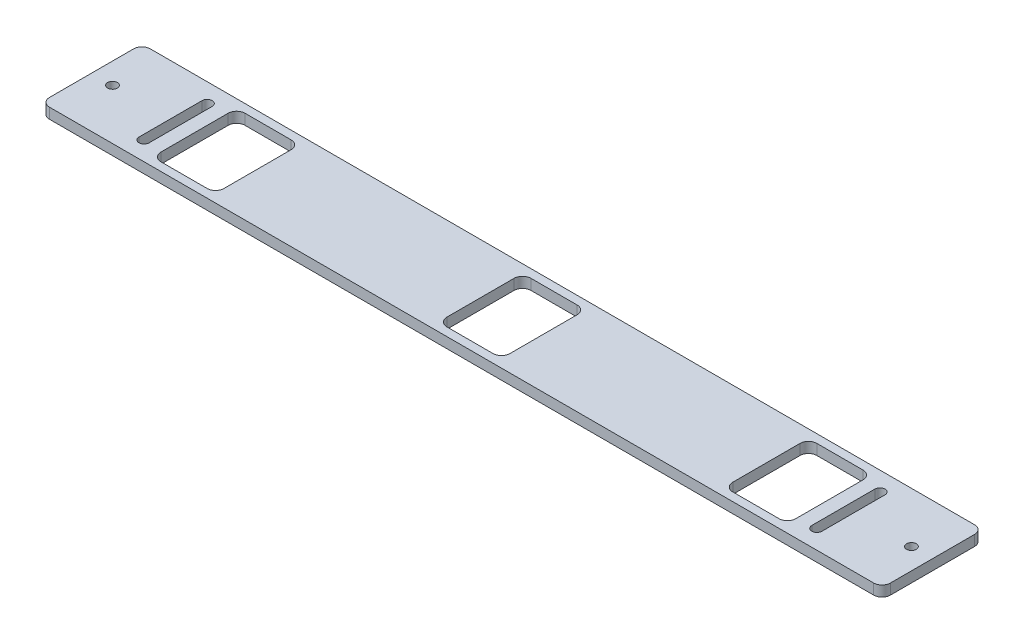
SolidWorks part; units mm, degrees
ref_plane "Front" through (0, 0, 0) normal (0, 0, 1) x (1, 0, 0)
ref_plane "Top" through (0, 0, 0) normal (0, 1, 0) x (1, 0, 0)
ref_plane "Right" through (0, 0, 0) normal (1, 0, 0) x (0, 0, -1)
sketch "Sketch1" plane through (0, 0, 0) normal (0, 1, 0) x (1, 0, 0)
  line L0 (0, 15.24) -> (254, 15.24) construction
  line L1 (0, 0) -> (254, 0)
  line L2 (0, 0) -> (0, 30.48)
  line L3 (0, 30.48) -> (254, 30.48)
  line L4 (254, 0) -> (254, 30.48)
  line L5 (127, 30.48) -> (127, 0) construction
  line L6 (31.115, 27.94) -> (50.165, 27.94)
  line L7 (31.115, 27.94) -> (31.115, 2.54)
  line L8 (31.115, 2.54) -> (50.165, 2.54)
  line L9 (50.165, 27.94) -> (50.165, 2.54)
  line L10 (117.475, 27.94) -> (136.525, 27.94)
  line L11 (117.475, 27.94) -> (117.475, 2.54)
  line L12 (117.475, 2.54) -> (136.525, 2.54)
  line L13 (136.525, 27.94) -> (136.525, 2.54)
  line L14 (203.835, 27.94) -> (222.885, 27.94)
  line L15 (203.835, 27.94) -> (203.835, 2.54)
  line L16 (203.835, 2.54) -> (222.885, 2.54)
  line L17 (222.885, 27.94) -> (222.885, 2.54)
  line L18 (40.64, 27.94) -> (40.64, 2.54) construction
  line L19 (213.36, 27.94) -> (213.36, 2.54) construction
  line L20 (25.4, 5.715) -> (25.4, 24.765) construction
  line L21 (23.876, 5.715) -> (23.876, 24.765)
  line L22 (26.924, 5.715) -> (26.924, 24.765)
  line L23 (228.6, 5.715) -> (228.6, 24.765) construction
  line L24 (230.124, 5.715) -> (230.124, 24.765)
  line L25 (227.076, 5.715) -> (227.076, 24.765)
  arc A0 (23.876, 5.715) -> (26.924, 5.715) centre (25.4, 5.715) ccw
  arc A1 (26.924, 24.765) -> (23.876, 24.765) centre (25.4, 24.765) ccw
  arc A2 (230.124, 5.715) -> (227.076, 5.715) centre (228.6, 5.715) cw
  arc A3 (227.076, 24.765) -> (230.124, 24.765) centre (228.6, 24.765) cw
  point P19 (31.115, 15.24)
  point P21 (127, 27.94)
  point P29 (25.4, 15.24)
  point P36 (228.6, 15.24)
  dimension "D9" = 3.048
  dimension "D1" = 30.48
  dimension "D2" = 254
  dimension "D3" = 19.05
  dimension "D4" = 25.4
  dimension "D5" = 86.36
  dimension "D6" = 86.36
  dimension "D7" = 19.05
  dimension "D8" = 15.24
extrude "Boss-Extrude1" add sketch "Sketch1" along normal blind 3.175
fillet "Fillet1" radius 2.54 16 edges at (203.835, 1.5875, -27.94) (203.835, 1.5875, -2.54) (222.885, 1.5875, -2.54) (222.885, 1.5875, -27.94) (136.525, 1.5875, -27.94) (117.475, 1.5875, -27.94) (117.475, 1.5875, -2.54) (136.525, 1.5875, -2.54) (50.165, 1.5875, -2.54) (31.115, 1.5875, -2.54) (50.165, 1.5875, -27.94) (31.115, 1.5875, -27.94) (254, 1.5875, 0) (254, 1.5875, -30.48) (0, 1.5875, 0) (0, 1.5875, -30.48)
hole_wizard "#4 Clearance Hole1" positions "Sketch3" profile "Sketch2" hole size "#4" standard "ANSI Inch"
sketch "Sketch3" plane through (0, 3.175, 0) normal (0, 1, 0) x (1, 0, 0)
  line L0 (0, 15.24) -> (254, 15.24) construction
  line L1 (0, 27.94) -> (0, 2.54) construction
  line L2 (254, 2.54) -> (254, 27.94) construction
  line L3 (127, 30.48) -> (127, 0) construction
  line L4 (251.46, 30.48) -> (2.54, 30.48) construction
  line L5 (2.54, 0) -> (251.46, 0) construction
  point P9 (6.35, 15.24)
  point P19 (247.65, 15.24)
  dimension "D1" = 6.35
  dimension "D2" = 120.65
sketch "Sketch2" plane through (6.35, 3.175, -15.24) normal (1, 0, 0) x (0, 0, 1)
  line L0 (0, 0) -> (0, 3.175)
  line L1 (0, 3.175) -> (1.4732, 3.175)
  line L2 (1.4732, 3.175) -> (1.4732, 0)
  line L5 (1.4732, 0) -> (0, 0)
  line L11 (0, -6.35) -> (0, 107.95) construction
  dimension "Thru Hole Dia." = 2.9464
  dimension "Thru Hole Depth" = 3.175
